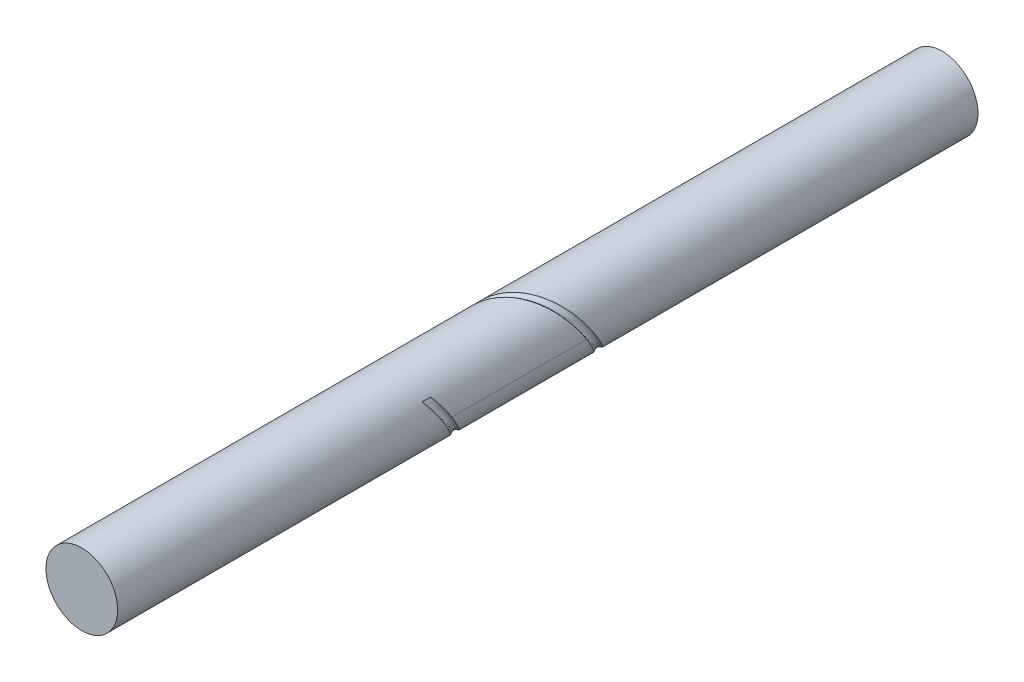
SolidWorks part; units mm, degrees
ref_plane "Front Plane" through (0, 0, 0) normal (0, 0, 1) x (1, 0, 0)
ref_plane "Top Plane" through (0, 0, 0) normal (0, 1, 0) x (1, 0, 0)
ref_plane "Right Plane" through (0, 0, 0) normal (1, 0, 0) x (0, 0, -1)
sketch "Sketch1" plane through (0, 0, 0) normal (0, 0, 1) x (1, 0, 0)
  circle A0 centre (0, 0) radius 25
  dimension "D1" = 50
extrude "Boss-Extrude1" add sketch "Sketch1" along normal blind 600
ref_plane "Plane1" through (0, 0, 220) normal (0, 0, 1) x (1, 0, 0)
sketch "Sketch2" plane through (0, 0, 220) normal (0, 0, 1) x (1, 0, 0)
  circle A0 centre (0, 0) radius 27.646
  dimension "D1" = 55.292
curve "Helix/Spiral1"
sketch "Sketch3" plane through (0, 0, 0) normal (0, 1, 0) x (1, 0, 0)
  circle A0 centre (-27.646, -220) radius 3.969
  spline S0 degree 3 poles (-27.646, -220) (-27.646, -221.3307) (-27.0608, -224.0012) (-24.4828, -227.9997) (-20.3663, -232.0001) (-14.9702, -236) (-8.6335, -240) (-1.7543, -244) (5.2352, -248) (11.8957, -252) (17.8087, -256) (22.6028, -260) (25.9766, -264) (27.7183, -268) (27.7183, -272) (25.9766, -276) (22.6028, -280) (17.8087, -284) (11.8957, -288) (5.2352, -292) (-1.7543, -296) (-8.6335, -300) (-14.9702, -304) (-20.3663, -308) (-24.4828, -312) (-27.0608, -316) (-27.9386, -320) (-27.0608, -324) (-24.4828, -328) (-20.3663, -332) (-14.9702, -336) (-8.6335, -340) (-1.7543, -344) (5.2352, -348) (11.8957, -352) (17.8087, -356) (22.6028, -360) (25.9766, -364) (27.7184, -367.9999) (27.7179, -372.0003) (25.9779, -375.9988) (23.7247, -378.6693) (22.3661, -380) knots 0 0 0 0 0.025 0.05 0.075 0.1 0.125 0.15 0.175 0.2 0.225 0.25 0.275 0.3 0.325 0.35 0.375 0.4 0.425 0.45 0.475 0.5 0.525 0.55 0.575 0.6 0.625 0.65 0.675 0.7 0.725 0.75 0.775 0.8 0.825 0.85 0.875 0.9 0.925 0.95 0.975 1 1 1 1 construction
  dimension "D1" = 7.938
sweep "Cut-Sweep1" cut profiles "Sketch3" path "Helix/Spiral1"
pattern_linear "LPattern1" [suppressed] count 2 spacing 500
